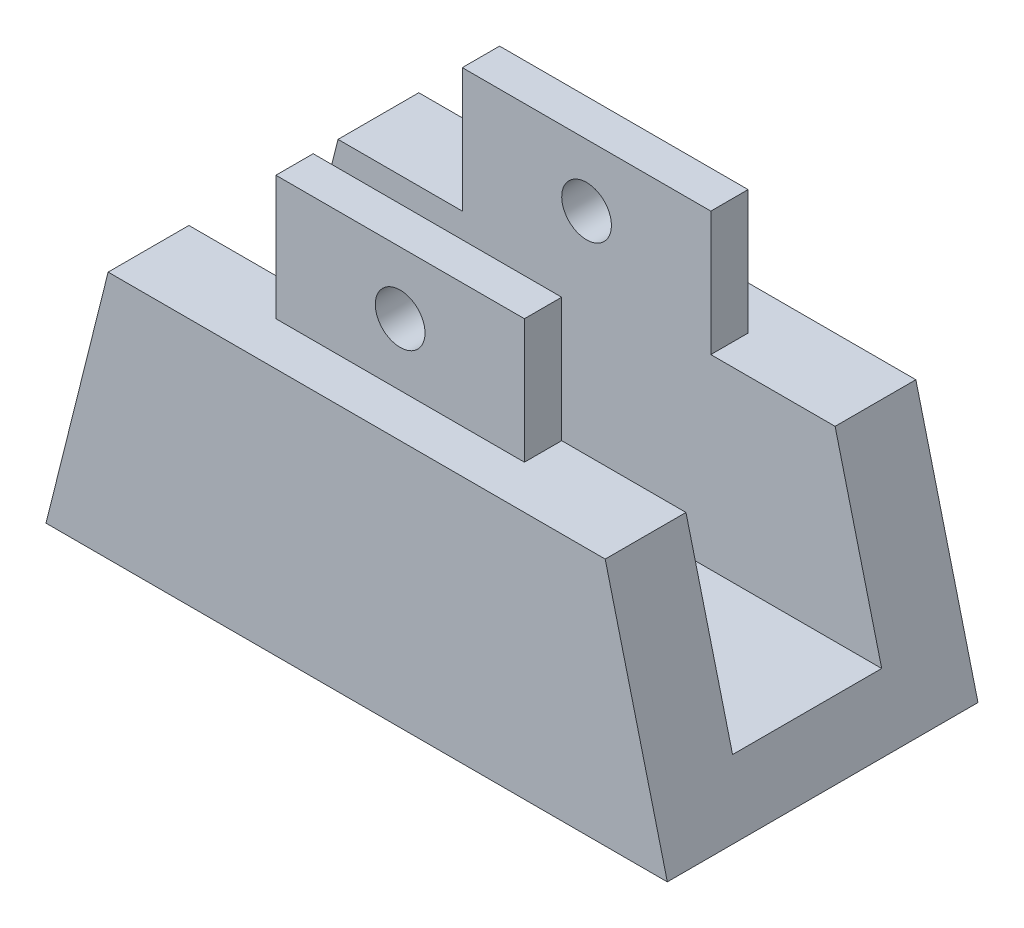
SolidWorks part; units mm, degrees
ref_plane "Front Plane" through (0, 0, 0) normal (0, 0, 1) x (1, 0, 0)
ref_plane "Top Plane" through (0, 0, 0) normal (0, 1, 0) x (1, 0, 0)
ref_plane "Right Plane" through (0, 0, 0) normal (1, 0, 0) x (0, 0, -1)
sketch "Sketch1" plane through (0, 0, 0) normal (0, 0, 1) x (1, 0, 0)
  line L0 (10, 10) -> (10, 5) construction
  line L1 (0, 0) -> (20, 0)
  line L2 (0, 0) -> (0, 10)
  line L3 (0, 10) -> (20, 10)
  line L4 (20, 0) -> (20, 10)
  circle A0 centre (10, 5) radius 2
  dimension "D1" = 4
  dimension "D2" = 20
  dimension "D3" = 5
  dimension "D4" = 10
extrude "Extrude1" add sketch "Sketch1" along normal mid plane 18
sketch "Sketch2" plane through (0, 0, 0) normal (-1, 0, 0) x (0, 0, 1)
  line L0 (9, 10) -> (-9, 10) construction
  line L1 (-6, 10) -> (6, 10)
  line L2 (-6, 10) -> (-6, 0)
  line L3 (-6, 0) -> (6, 0)
  line L4 (6, 10) -> (6, 0)
  line L5 (9, 0) -> (-9, 0) construction
  line L6 (-9, 10) -> (-9, 0) construction
  line L7 (9, 10) -> (9, 0) construction
  dimension "D1" = 3
  dimension "D2" = 3
extrude "Extrude2" cut sketch "Sketch2" against normal through all
sketch "Sketch3" plane through (0, 0, 0) normal (0, 0, 1) x (1, 0, 0)
  line L0 (-10, 0) -> (30, 0)
  line L1 (10, 5) -> (10, 0) construction
  line L2 (-10, 0) -> (-15, -20)
  line L3 (-15, -20) -> (35, -20)
  line L4 (35, -20) -> (30, 0)
  dimension "D1" = 40
  dimension "D2" = 50
  dimension "D3" = 20
extrude "Extrude3" add sketch "Sketch3" along normal mid plane 25
sketch "Sketch4" plane through (0, 0, 0) normal (0, 0, 1) x (1, 0, 0)
  line L0 (-12, -8) -> (10, 0)
  line L1 (-10, 0) -> (-15, -20) construction
  line L2 (30, 0) -> (-10, 0) construction
  line L3 (-12, -8) -> (-10, 0)
  line L4 (-10, 0) -> (10, 0)
  dimension "D1" = 8
  dimension "D2" = 20
extrude "Extrude4" cut sketch "Sketch4" against normal mid plane 12
sketch "Sketch5" plane through (0, 0, 0) normal (1, 0, 0) x (0, 0, -1)
  line L0 (-6, 0) -> (-6, 10) construction
  line L1 (6, 10) -> (-6, 10)
  line L2 (6, 10) -> (6, -15)
  line L3 (6, -15) -> (-6, -15)
  line L4 (-6, 10) -> (-6, -15)
  dimension "D1" = 25
extrude "Extrude5" cut sketch "Sketch5" along normal through all and the other way through all
